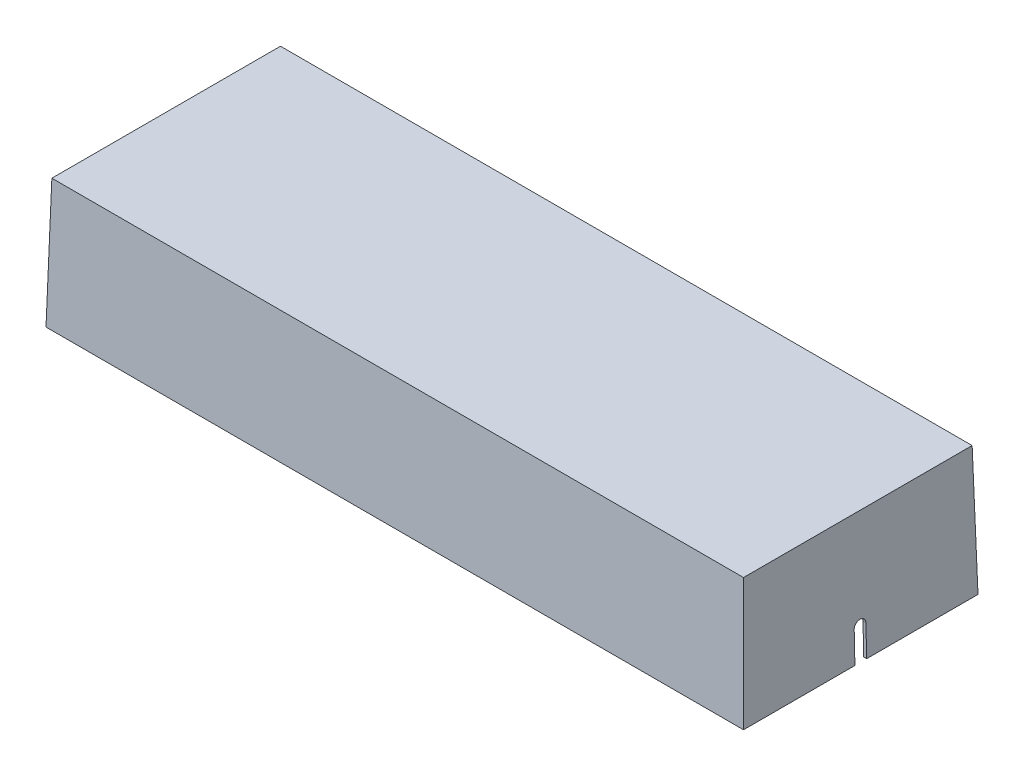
SolidWorks part; units mm, degrees
ref_plane "Plan de face" through (0, 0, 0) normal (0, 0, 1) x (1, 0, 0)
ref_plane "Plan de dessus" through (0, 0, 0) normal (0, 1, 0) x (1, 0, 0)
ref_plane "Plan de droite" through (0, 0, 0) normal (1, 0, 0) x (0, 0, -1)
sketch "Esquisse1" plane through (0, 0, 0) normal (0, 1, 0) x (1, 0, 0)
  line L1 (-119, 40) -> (119, 40)
  line L2 (-119, 40) -> (-119, -40)
  line L3 (-119, -40) -> (119, -40)
  line L4 (119, 40) -> (119, -40)
  dimension "D1" = 80
  dimension "D2" = 238
  dimension "D3" = 119
  dimension "D4" = 40
extrude "Extrusion1" add sketch "Esquisse1" along normal blind 44
draft "Dépouille2" type of draft neutral plane draft angle 1.3 faces to draft 2 parameters "D1"=1.3
shell "Coque1" thickness 1
sketch "Esquisse2" plane through (0, 43, 0) normal (0, -1, 0) x (1, 0, 0)
  line L0 (27.5, 38.0239) -> (27.5, -38.0239)
  line L1 (-117.0239, 38.0239) -> (117.0239, 38.0239) construction
  line L2 (117.0239, -38.0239) -> (-117.0239, -38.0239) construction
  line L3 (27.5, -38.0239) -> (29, -38.0239)
  line L4 (29, -38.0239) -> (29, 38.0239)
  line L5 (29, 38.0239) -> (27.5, 38.0239)
  line L6 (0, 0) -> (0, 41.3618) construction
  line L7 (-27.5, -38.0239) -> (-29, -38.0239)
  line L8 (-29, 38.0239) -> (-27.5, 38.0239)
  line L9 (-27.5, 38.0239) -> (-27.5, -38.0239)
  line L10 (-29, -38.0239) -> (-29, 38.0239)
  dimension "D1" = 27.5
  dimension "D2" = 29
extrude "Extrusion2" add sketch "Esquisse2" along normal blind 2
sketch "Esquisse3" plane through (0, 43, 0) normal (0, -1, 0) x (1, 0, 0)
  line L0 (0, 44.1457) -> (0, -45.5254) construction
  line L2 (31, 38.0239) -> (31, -38.0239)
  line L3 (29, 38.0239) -> (117.0239, 38.0239) construction
  line L4 (117.0239, -38.0239) -> (29, -38.0239) construction
  line L5 (31, -38.0239) -> (32.5, -38.0239)
  line L6 (32.5, -38.0239) -> (32.5, 38.0239)
  line L7 (32.5, 38.0239) -> (31, 38.0239)
  line L8 (34.5, 38.0239) -> (34.5, -38.0239)
  line L9 (34.5, -38.0239) -> (36, -38.0239)
  line L10 (36, -38.0239) -> (36, 38.0239)
  line L11 (36, 38.0239) -> (34.5, 38.0239)
  line L12 (29, -38.0239) -> (29, 38.0239) construction
  line L13 (-32.5, 38.0239) -> (-31, 38.0239)
  line L14 (-36, 38.0239) -> (-34.5, 38.0239)
  line L15 (-31, -38.0239) -> (-32.5, -38.0239)
  line L16 (-31, 38.0239) -> (-31, -38.0239)
  line L17 (-32.5, -38.0239) -> (-32.5, 38.0239)
  line L18 (-34.5, 38.0239) -> (-34.5, -38.0239)
  line L19 (-34.5, -38.0239) -> (-36, -38.0239)
  line L20 (-36, -38.0239) -> (-36, 38.0239)
  dimension "D1" = 2
  dimension "D2" = 1.5
  dimension "D3" = 2
  dimension "D4" = 1.5
extrude "Extrusion3" add sketch "Esquisse3" along normal blind 2
sketch "Esquisse6" plane through (0, 43, 0) normal (0, -1, 0) x (1, 0, 0)
  line L0 (0, 0) -> (0, -44.233) construction
  line L1 (32.5, -38.0239) -> (32.5, -35.0239)
  line L2 (32.5, -38.0239) -> (32.5, 38.0239) construction
  line L3 (32.5, -35.0239) -> (31, -35.0239)
  line L4 (31, 38.0239) -> (31, -38.0239) construction
  line L5 (31, -35.0239) -> (31, -38.0239)
  line L6 (31, -38.0239) -> (32.5, -38.0239) construction
  line L7 (31, -38.0239) -> (32.5, -38.0239)
  line L8 (29, -38.0239) -> (29, -35.0239)
  line L9 (29, -38.0239) -> (29, 38.0239) construction
  line L10 (29, -35.0239) -> (27.5, -35.0239)
  line L11 (27.5, 38.0239) -> (27.5, -38.0239) construction
  line L12 (27.5, -35.0239) -> (27.5, -38.0239)
  line L13 (27.5, -38.0239) -> (29, -38.0239)
  line L14 (-27.5, -38.0239) -> (-29, -38.0239)
  line L15 (-29, -35.0239) -> (-27.5, -35.0239)
  line L16 (-27.5, -35.0239) -> (-27.5, -38.0239)
  line L17 (-29, -38.0239) -> (-29, -35.0239)
  line L18 (-31, -38.0239) -> (-32.5, -38.0239)
  line L19 (-31, -35.0239) -> (-31, -38.0239)
  line L20 (-32.5, -35.0239) -> (-31, -35.0239)
  line L21 (-32.5, -38.0239) -> (-32.5, -35.0239)
  dimension "D1" = 3
  dimension "D2" = 3
extrude "Extrusion6" add sketch "Esquisse6" along normal blind 28
sketch "Esquisse7" plane through (0, 43, 0) normal (0, -1, 0) x (1, 0, 0)
  line L0 (0, 0) -> (0, -43.4496) construction
  line L1 (36, -38.0239) -> (36, -35.0239)
  line L2 (36, -38.0239) -> (36, 38.0239) construction
  line L3 (36, -35.0239) -> (34.5, -35.0239)
  line L4 (34.5, 38.0239) -> (34.5, -38.0239) construction
  line L5 (34.5, -35.0239) -> (34.5, -38.0239)
  line L6 (34.5, -38.0239) -> (36, -38.0239)
  line L7 (-34.5, -38.0239) -> (-36, -38.0239)
  line L8 (-34.5, -35.0239) -> (-34.5, -38.0239)
  line L9 (-36, -35.0239) -> (-34.5, -35.0239)
  line L10 (-36, -38.0239) -> (-36, -35.0239)
  dimension "D1" = 3
extrude "Extrusion7" add sketch "Esquisse7" along normal blind 28
sketch "Esquisse8" plane through (0, 43, 0) normal (0, -1, 0) x (1, 0, 0)
  line L0 (0, 0) -> (0, 41.4894) construction
  line L1 (36, 38.0239) -> (36, 35.0239)
  line L3 (36, -35.0239) -> (36, 38.0239) construction
  line L4 (36, 35.0239) -> (34.5, 35.0239)
  line L5 (34.5, 38.0239) -> (34.5, -35.0239) construction
  line L6 (34.5, 35.0239) -> (34.5, 38.0239)
  line L7 (34.5, 38.0239) -> (36, 38.0239)
  line L8 (32.5, 38.0239) -> (32.5, 35.0239)
  line L9 (32.5, -35.0239) -> (32.5, 38.0239) construction
  line L10 (32.5, 35.0239) -> (31, 35.0239)
  line L11 (31, 38.0239) -> (31, -35.0239) construction
  line L12 (31, 35.0239) -> (31, 38.0239)
  line L13 (31, 38.0239) -> (32.5, 38.0239)
  line L14 (29, 38.0239) -> (29, 35.0239)
  line L15 (29, -35.0239) -> (29, 38.0239) construction
  line L16 (29, 35.0239) -> (27.5, 35.0239)
  line L17 (27.5, 38.0239) -> (27.5, -35.0239) construction
  line L18 (27.5, 35.0239) -> (27.5, 38.0239)
  line L19 (27.5, 38.0239) -> (29, 38.0239)
  line L20 (-27.5, 35.0239) -> (-27.5, 38.0239)
  line L21 (-29, 35.0239) -> (-27.5, 35.0239)
  line L22 (-29, 38.0239) -> (-29, 35.0239)
  line L23 (-27.5, 38.0239) -> (-29, 38.0239)
  line L24 (-31, 35.0239) -> (-31, 38.0239)
  line L25 (-31, 38.0239) -> (-32.5, 38.0239)
  line L26 (-32.5, 38.0239) -> (-32.5, 35.0239)
  line L27 (-32.5, 35.0239) -> (-31, 35.0239)
  line L28 (-36, 35.0239) -> (-34.5, 35.0239)
  line L29 (-34.5, 35.0239) -> (-34.5, 38.0239)
  line L30 (-34.5, 38.0239) -> (-36, 38.0239)
  line L31 (-36, 38.0239) -> (-36, 35.0239)
  dimension "D1" = 3
  dimension "D2" = 3
  dimension "D3" = 3
extrude "Extrusion8" add sketch "Esquisse8" along normal blind 28
sketch "Esquisse9" plane through (0, 0, 0) normal (1, 0, 0) x (0, 0, -1)
  line L0 (-2, 0) -> (-2, 10.5)
  line L1 (-40, 0) -> (40, 0) construction
  line L2 (2, 0) -> (2, 10.5)
  arc A0 (-2, 10.5) -> (2, 10.5) centre (0, 10.5) cw
  dimension "D1" = 10.5
  dimension "D2" = 4
  dimension "D3" = 2
extrude "Enlèv. mat.-Extru.1" cut sketch "Esquisse9" against normal through all and the other way through all
